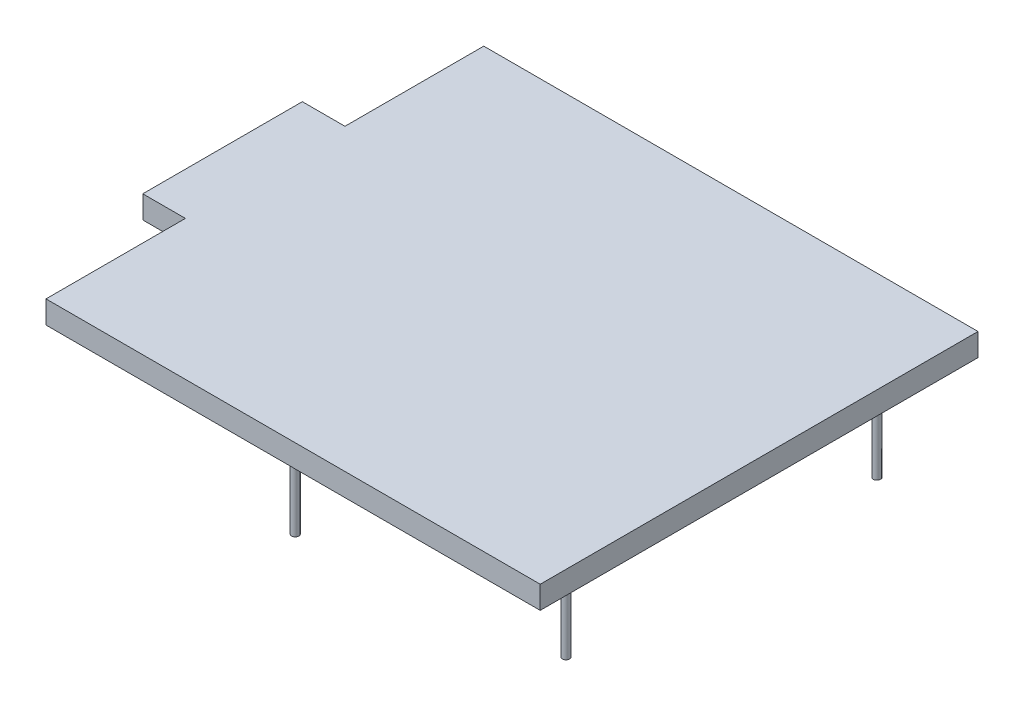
SolidWorks part; units mm, degrees
ref_plane "Front Plane" through (0, 0, 0) normal (0, 0, 1) x (1, 0, 0)
ref_plane "Top Plane" through (0, 0, 0) normal (0, 1, 0) x (1, 0, 0)
ref_plane "Right Plane" through (0, 0, 0) normal (1, 0, 0) x (0, 0, -1)
sketch "Sketch1" plane through (0, 0, 0) normal (0, 1, 0) x (1, 0, 0)
  line L0 (178.1945, -68.3693) -> (414.9225, -68.4963) construction
  line L1 (196.9905, 28.0237) -> (414.9225, 28.0237)
  line L2 (196.9905, 28.0237) -> (196.9905, -33.1903)
  line L3 (196.9905, -165.0163) -> (414.9225, -165.0163)
  line L4 (414.9225, 28.0237) -> (414.9225, -165.0163)
  line L5 (196.9905, 28.0237) -> (414.9225, -165.0163) construction
  line L6 (196.9905, -165.0163) -> (414.9225, 28.0237) construction
  line L7 (178.1945, -33.1903) -> (196.9905, -33.1903)
  line L8 (178.1945, -33.1903) -> (178.1945, -103.5483)
  line L9 (178.1945, -103.5483) -> (196.9905, -103.5483)
  line L10 (196.9905, -165.0163) -> (196.9905, -103.5483)
  dimension "D1" = 217.932
  dimension "D2" = 70.358
  dimension "D3" = 61.468
  dimension "D4" = 193.04
  dimension "D5" = 18.796
extrude "Boss-Extrude1" add sketch "Sketch1" along normal blind 10
sketch "Sketch2" plane through (0, 0, 0) normal (0, -1, 0) x (1, 0, 0)
  line L0 (178.1945, 68.6233) -> (414.9225, 68.4963) construction
  line L1 (196.9905, 165.0163) -> (414.9225, 165.0163) construction
  line L2 (196.9905, 165.0163) -> (196.9905, 103.8023) construction
  line L3 (196.9905, -28.0237) -> (414.9225, -28.0237) construction
  line L4 (414.9225, 165.0163) -> (414.9225, -28.0237) construction
  line L5 (196.9905, 165.0163) -> (414.9225, -28.0237) construction
  line L6 (196.9905, -28.0237) -> (414.9225, 165.0163) construction
  line L7 (178.1945, 103.8023) -> (196.9905, 103.8023) construction
  line L8 (178.1945, 103.8023) -> (178.1945, 33.4443) construction
  line L9 (178.1945, 33.4443) -> (196.9905, 33.4443) construction
  line L10 (196.9905, -28.0237) -> (196.9905, 33.4443) construction
  circle A0 centre (291.7005, 149.8425) radius 1.6
  circle A1 centre (398.3805, 137.0852) radius 1.6
  circle A2 centre (398.3069, -0.0747) radius 1.6
  circle A3 centre (291.6133, -12.7175) radius 1.6
  point P0 (305.9565, 68.4963)
  point P19 (414.9225, -28.0237)
  dimension "D6" = 3.2
  dimension "D1" = 217.932
  dimension "D2" = 70.358
  dimension "D3" = 61.468
  dimension "D4" = 193.04
  dimension "D5" = 18.796
  dimension "D7" = 81.28
  dimension "D8" = 68.58
  dimension "D9" = 94.71
  dimension "D10" = 106.68
extrude "Boss-Extrude2" add sketch "Sketch2" along normal blind 40
